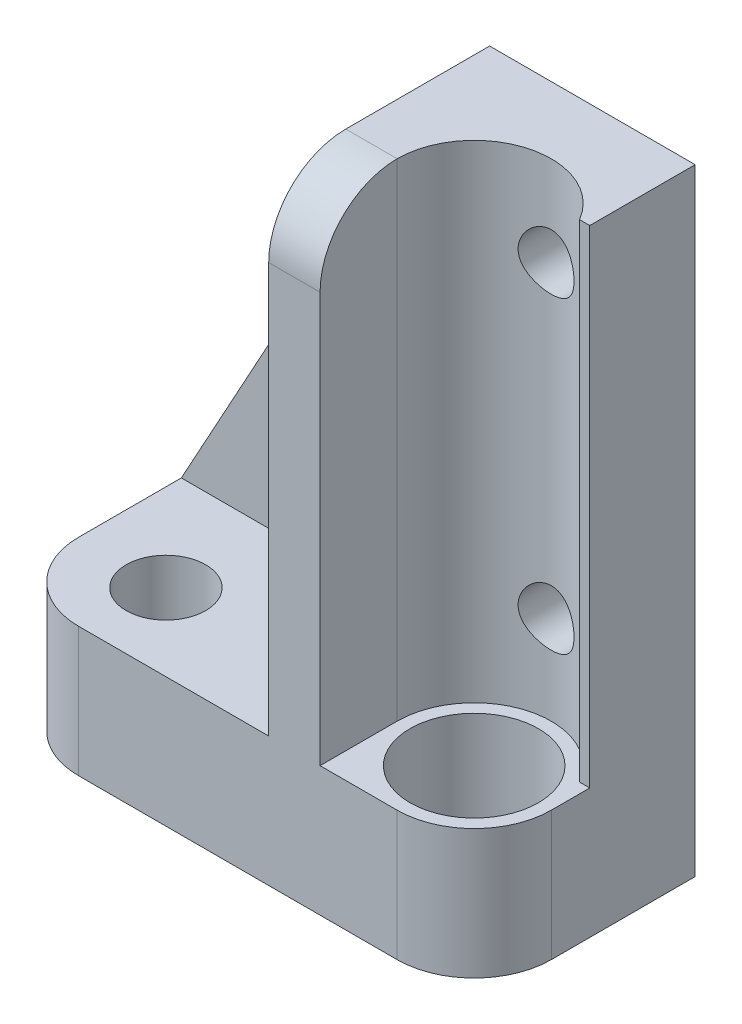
SolidWorks part; units mm, degrees
ref_plane "Front Plane" through (0, 0, 0) normal (0, 0, 1) x (1, 0, 0)
ref_plane "Top Plane" through (0, 0, 0) normal (0, 1, 0) x (1, 0, 0)
ref_plane "Right Plane" through (0, 0, 0) normal (1, 0, 0) x (0, 0, -1)
sketch "Sketch1" plane through (0, 0, 0) normal (0, 0, 1) x (1, 0, 0)
  line L0 (-24.4475, 0) -> (4.7625, 0)
  line L1 (4.7625, 0) -> (4.7625, 38.1)
  line L2 (4.7625, 38.1) -> (-7.9375, 38.1)
  line L3 (-7.9375, 38.1) -> (-24.4475, 8.001)
  line L4 (-24.4475, 8.001) -> (-24.4475, 0)
  dimension "D1" = 38.1
  dimension "D2" = 29.21
  dimension "D3" = 8.001
  dimension "D4" = 12.7
  dimension "D5" = 4.7625
extrude "Boss-Extrude1" add sketch "Sketch1" along normal mid plane 17.78
sketch "Sketch3" plane through (0, 38.1, 0) normal (0, 1, 0) x (1, 0, 0)
  line L1 (-7.9375, -8.89) -> (-24.4475, -8.89) construction
  line L3 (-24.4475, -8.89) -> (-24.4475, 8.89) construction
  line L5 (-7.9375, 6.35) -> (-7.9375, -8.89)
  line L10 (4.1275, 2.376) -> (4.7625, 2.376)
  line L11 (4.7625, -8.89) -> (4.7625, 8.89) construction
  line L12 (-24.4475, 6.35) -> (-24.4475, -8.89)
  line L13 (-24.4475, -8.89) -> (-7.9375, -8.89)
  line L14 (4.7625, -8.89) -> (-7.9375, -8.89) construction
  line L15 (4.7625, -8.89) -> (4.7625, 2.376)
  line L16 (-4.7625, 0) -> (-4.7625, -8.89)
  line L17 (-7.9375, -8.89) -> (-7.9375, 8.89) construction
  line L18 (-7.9375, 6.35) -> (-24.4475, 6.35)
  line L19 (-4.7625, -8.89) -> (4.7625, -8.89)
  line L20 (-7.9375, 8.89) -> (-24.4475, 8.89) construction
  arc A1 (4.1275, 2.376) -> (-4.7625, 0) centre (0, 0) ccw
  dimension "D1" = 9.525
  dimension "D2" = 0.635
  dimension "D3" = 2.54
  dimension "D4" = 2.54
extrude "Cut-Extrude2" cut sketch "Sketch3" against normal up to vertex (30.099 mm away)
sketch "Sketch5" plane through (0, 38.1, 0) normal (0, 1, 0) x (1, 0, 0)
  line L0 (4.7625, -8.89) -> (4.7625, 2.376) construction
  line L1 (-24.4475, -8.89) -> (4.7625, -8.89)
  line L2 (-24.4475, -8.89) -> (-24.4475, -4.7625)
  line L3 (-24.4475, -4.7625) -> (4.7625, -4.7625)
  line L4 (4.7625, -8.89) -> (4.7625, -4.7625)
  line L6 (-24.4475, -8.89) -> (-24.4475, 8.89) construction
  line L7 (-24.4475, -8.89) -> (4.7625, -8.89) construction
  arc A0 (4.1275, 2.376) -> (-4.7625, 0) centre (0, 0) ccw construction
  dimension "D1" = 9.525
extrude "Cut-Extrude4" cut sketch "Sketch5" against normal through all
hole_wizard "CBORE for #8 Socket Head Cap Screw1" positions "Sketch6" profile "Sketch7" counterbore size "#8" standard "ANSI Inch"
sketch "Sketch6" plane through (0, 8.001, 0) normal (0, 1, 0) x (1, 0, 0)
  arc A0 (4.1275, 2.376) -> (-4.7625, 0) centre (0, 0) ccw construction
  point P2 (0, 0)
sketch "Sketch7" plane through (0, 8.001, 0) normal (1, 0, 0) x (0, 0, 1)
  line L0 (0, 0) -> (0, 8.001)
  line L1 (0, 8.001) -> (2.4574, 8.001)
  line L3 (2.4574, 8.001) -> (2.4574, 5.8166)
  line L4 (2.4574, 5.8166) -> (3.9687, 5.8166)
  line L5 (3.9687, 5.8166) -> (3.9688, 0)
  line L7 (3.9688, 0) -> (0, 0)
  line L11 (0, -6.35) -> (0, 107.95) construction
  dimension "Thru Hole Dia." = 4.9149
  dimension "Thru Hole Depth" = 8.001
  dimension "C'Bore Dia." = 7.9375
  dimension "C'Bore Depth" = 5.8166
hole_wizard "#10 (0.1935) Diameter Hole2" positions "Sketch8" profile "Sketch9" hole size "#10" standard "ANSI Inch"
sketch "Sketch8" plane through (0, 8.001, 0) normal (0, 1, 0) x (1, 0, 0)
  circle A0 centre (0, 0) radius 2.4574 construction
  point P0 (-19.05, 0)
  dimension "D1" = 19.05
sketch "Sketch9" plane through (-19.05, 8.001, 0) normal (1, 0, 0) x (0, 0, 1)
  line L0 (0, 0) -> (0, 8.001)
  line L1 (0, 8.001) -> (2.4574, 8.001)
  line L2 (2.4574, 8.001) -> (2.4574, 0)
  line L5 (2.4574, 0) -> (0, 0)
  line L11 (0, -6.35) -> (0, 107.95) construction
  dimension "Thru Hole Dia." = 4.9149
  dimension "Thru Hole Depth" = 8.001
hole_wizard "#8-32 Tapped Hole1" positions "Sketch11" profile "Sketch12" tap size "#8-32" standard "ANSI Inch"
sketch "Sketch11" plane through (0, 0, -8.89) normal (0, 0, -1) x (-1, 0, 0)
  line L0 (0, 8.001) -> (0, 38.1) construction
  line L2 (-4.7625, 38.1) -> (7.9375, 38.1) construction
  line L5 (0, 8.001) -> (0, 38.1) construction
  line L6 (4.7625, 8.001) -> (-4.1275, 8.001) construction
  line L7 (0, 23.0505) -> (-4.7625, 23.0505) construction
  line L8 (-4.7625, 8.001) -> (-4.7625, 38.1) construction
  point P0 (0, 32.5755)
  point P4 (0, 13.5255)
  point P30 (-2.361, 23.0505)
  point P33 (0, 0)
  dimension "D1" = 19.05
sketch "Sketch12" plane through (0, 32.5755, -8.89) normal (1, 0, 0) x (0, 1, 0)
  line L0 (0, 0) -> (0, 13.6525)
  line L1 (0, 13.6525) -> (1.7272, 13.6525)
  line L2 (1.7272, 13.6525) -> (1.7272, 0)
  line L5 (1.7272, 0) -> (0, 0)
  line L11 (0, -6.35) -> (0, 107.95) construction
  dimension "Thread Major Dia." = 3.4544
  dimension "Thru Tap Drill Depth" = 13.6525
fillet "Fillet1" radius 4.7625 4 edges at (-7.9375, 23.0505, -6.35) (-24.4475, 4.0005, 4.7625) (4.7625, 4.0005, 4.7625) (-6.35, 38.1, 4.7625)
